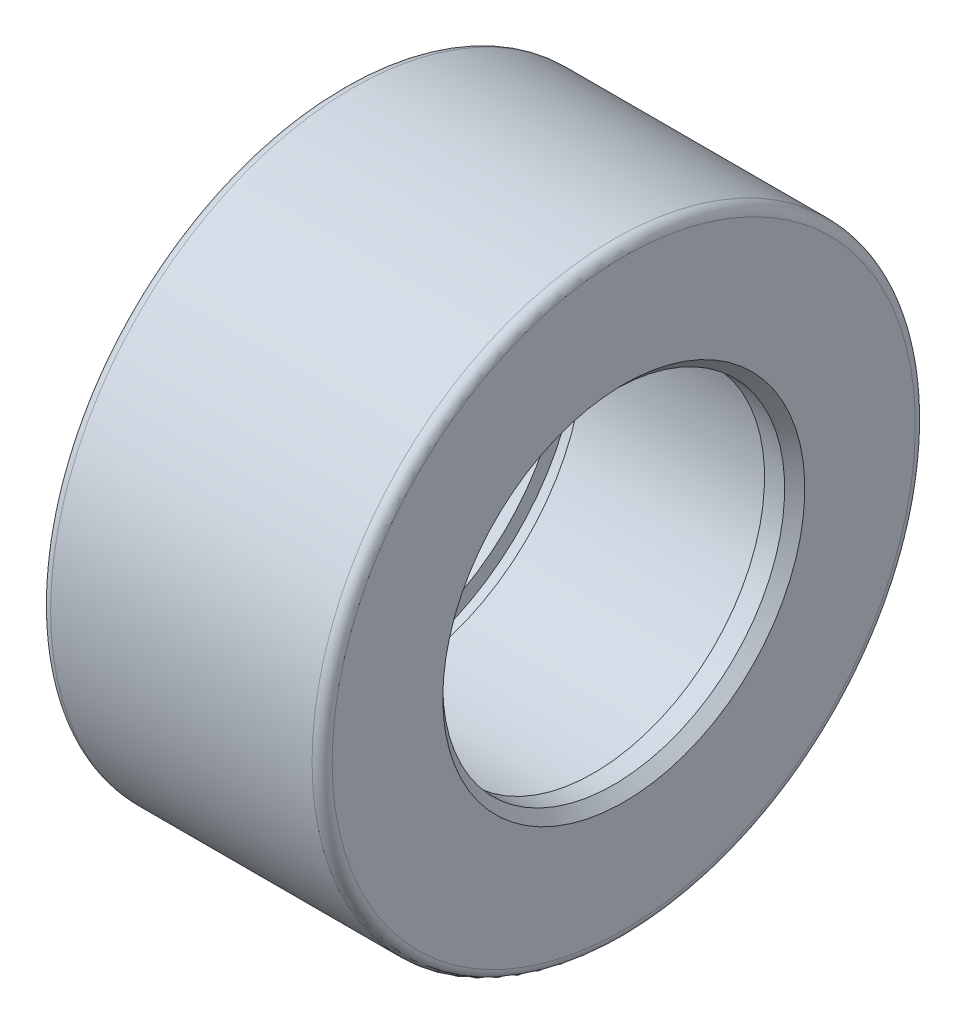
SolidWorks part; units mm, degrees
ref_plane "Plan de face" through (0, 0, 0) normal (0, 0, 1) x (1, 0, 0)
ref_plane "Plan de dessus" through (0, 0, 0) normal (0, 1, 0) x (1, 0, 0)
ref_plane "Plan de droite" through (0, 0, 0) normal (1, 0, 0) x (0, 0, -1)
sketch "Esquisse1" plane through (0, 0, 0) normal (0, 0, 1) x (1, 0, 0)
  line L0 (0, 8.5) -> (0, 15)
  line L1 (0, 15) -> (-14, 15)
  line L2 (-14, 15) -> (-14, 9.5)
  line L3 (-14, 9.5) -> (-12.5, 9.5)
  line L4 (-1.5, 9.5) -> (-1.5, 8.5)
  line L5 (-1.5, 8.5) -> (0, 8.5)
  line L6 (-21.0143, 0) -> (17.035, 0) construction
  line L7 (-12.5, 9.5) -> (-12.5, 10.25)
  line L8 (-12.5, 10.25) -> (-11.5, 10.25)
  line L9 (-11.5, 10.25) -> (-11.5, 9.5)
  line L10 (-11.5, 9.5) -> (-1.5, 9.5)
  point P15 (0, 15)
  point P18 (-14, 15)
  dimension "D5" = 1
  dimension "D1" = 9.5
  dimension "D2" = 14
  dimension "D3" = 0
  dimension "D4" = 15
  dimension "D6" = 1.5
  dimension "D7" = 10.25
  dimension "D8" = 1
  dimension "D9" = 10
revolve "Révolution1" add sketch "Esquisse1" angle 360 about L6
fillet "Congé1" radius 0.5 2 edges at (-14, 0, 15) (0, 0, 15)
chamfer "Chanfrein1" distance 0.5 angle 45 2 edges at (-14, 0, 9.5) (0, 0, 8.5)
